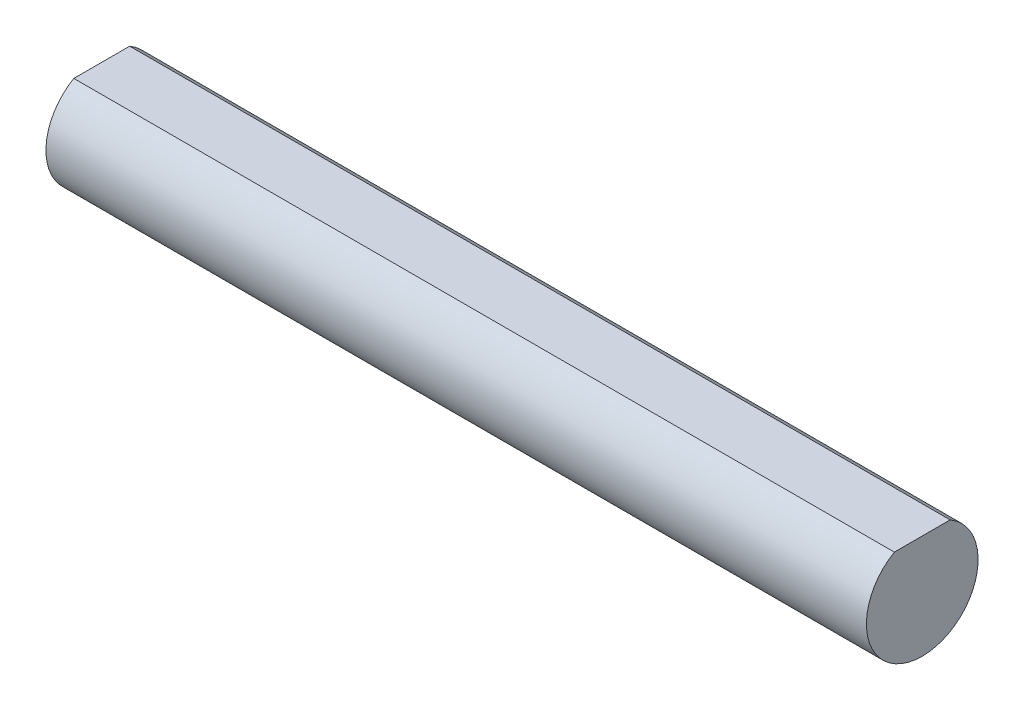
SolidWorks part; units mm, degrees
ref_plane "Front Plane" through (0, 0, 0) normal (0, 0, 1) x (1, 0, 0)
ref_plane "Top Plane" through (0, 0, 0) normal (0, 1, 0) x (1, 0, 0)
ref_plane "Right Plane" through (0, 0, 0) normal (1, 0, 0) x (0, 0, -1)
sketch "Sketch1" plane through (0, 0, 0) normal (1, 0, 0) x (0, 0, -1)
  line L1 (1.5, 2.5981) -> (-1.5, 2.5981)
  line L2 (-1.5, 2.5981) -> (-3, 0) construction
  line L3 (-3, 0) -> (-1.5, -2.5981) construction
  line L4 (-1.5, -2.5981) -> (1.5, -2.5981) construction
  line L5 (1.5, -2.5981) -> (3, 0) construction
  line L6 (3, 0) -> (1.5, 2.5981) construction
  circle A0 centre (0, 0) radius 2.5981 construction
  arc A1 (-1.5, 2.5981) -> (1.5, 2.5981) centre (0, 0) ccw
  dimension "D2" = 6
extrude "Boss-Extrude1" add sketch "Sketch1" along normal blind 44.1
